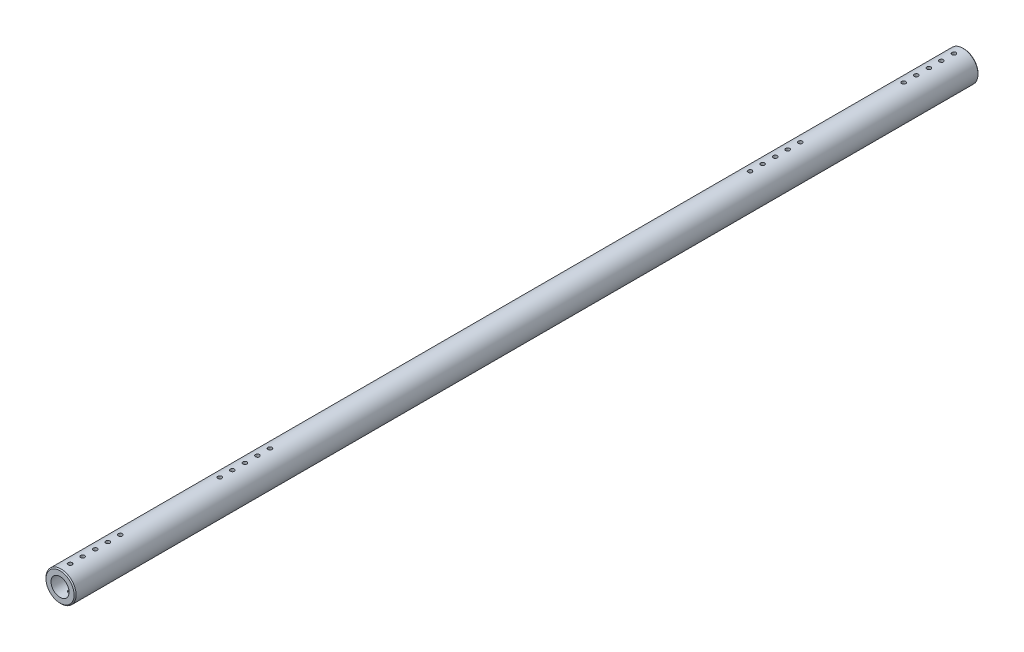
SolidWorks part; units mm, degrees
ref_plane "Plan1" through (0, 0, 0) normal (0, 0, 1) x (1, 0, 0)
ref_plane "Plan2" through (0, 0, 0) normal (0, 1, 0) x (1, 0, 0)
ref_plane "Plan3" through (0, 0, 0) normal (1, 0, 0) x (0, 0, -1)
sketch "Esquisse1" plane through (0, 0, 0) normal (0, 0, 1) x (1, 0, 0)
  circle A0 centre (0, 0) radius 15
  dimension "D1" = 30
extrude "Base-Extru.-Mince" add sketch "Esquisse1" along normal blind 900 thin
chamfer "Chanfrein1" distance 1 angle 45 2 edges at (15, 0, 0) (15, 0, 900)
sketch "Esquisse2" plane through (0, 0, 0) normal (0, 1, 0) x (1, 0, 0)
  line L0 (0, -899) -> (0, -1) construction
  line L2 (9, 0) -> (-9, 0) construction
  line L3 (-14, -900) -> (14, -900) construction
  circle A0 centre (0, -10) radius 2
  circle A1 centre (0, -22.5) radius 2
  circle A2 centre (0, -35) radius 2
  circle A3 centre (0, -163) radius 2
  circle A4 centre (0, -741) radius 2
  circle A5 centre (0, -865) radius 2
  circle A6 centre (0, -877.5) radius 2
  circle A7 centre (0, -890) radius 2
  circle A8 centre (0, -716) radius 2
  circle A9 centre (0, -47.5) radius 2
  circle A10 centre (0, -60) radius 2
  circle A11 centre (0, -852.5) radius 2
  circle A12 centre (0, -840) radius 2
  circle A13 centre (0, -728.5) radius 2
  circle A14 centre (0, -703.5) radius 2
  circle A15 centre (0, -691) radius 2
  circle A16 centre (0, -175.5) radius 2
  circle A17 centre (0, -188) radius 2
  circle A18 centre (0, -200.5) radius 2
  circle A19 centre (0, -213) radius 2
  dimension "D1" = 4
  dimension "D11" = 12.5
  dimension "D12" = 12.5
  dimension "D13" = 12.5
  dimension "D14" = 12.5
  dimension "D8" = 159
  dimension "D10" = 12.5
  dimension "D15" = 12.5
  dimension "D16" = 12.5
  dimension "D17" = 12.5
  dimension "D18" = 12.5
  dimension "D19" = 12.5
  dimension "D20" = 12.5
  dimension "D21" = 12.5
  dimension "D5" = 10
  dimension "D2" = 10
  dimension "D3" = 12.5
  dimension "D4" = 12.5
  dimension "D6" = 12.5
  dimension "D7" = 12.5
  dimension "D9" = 163
extrude "Enlèv. mat.-Extru.1" cut sketch "Esquisse2" against normal blind 10 and the other way blind 50
